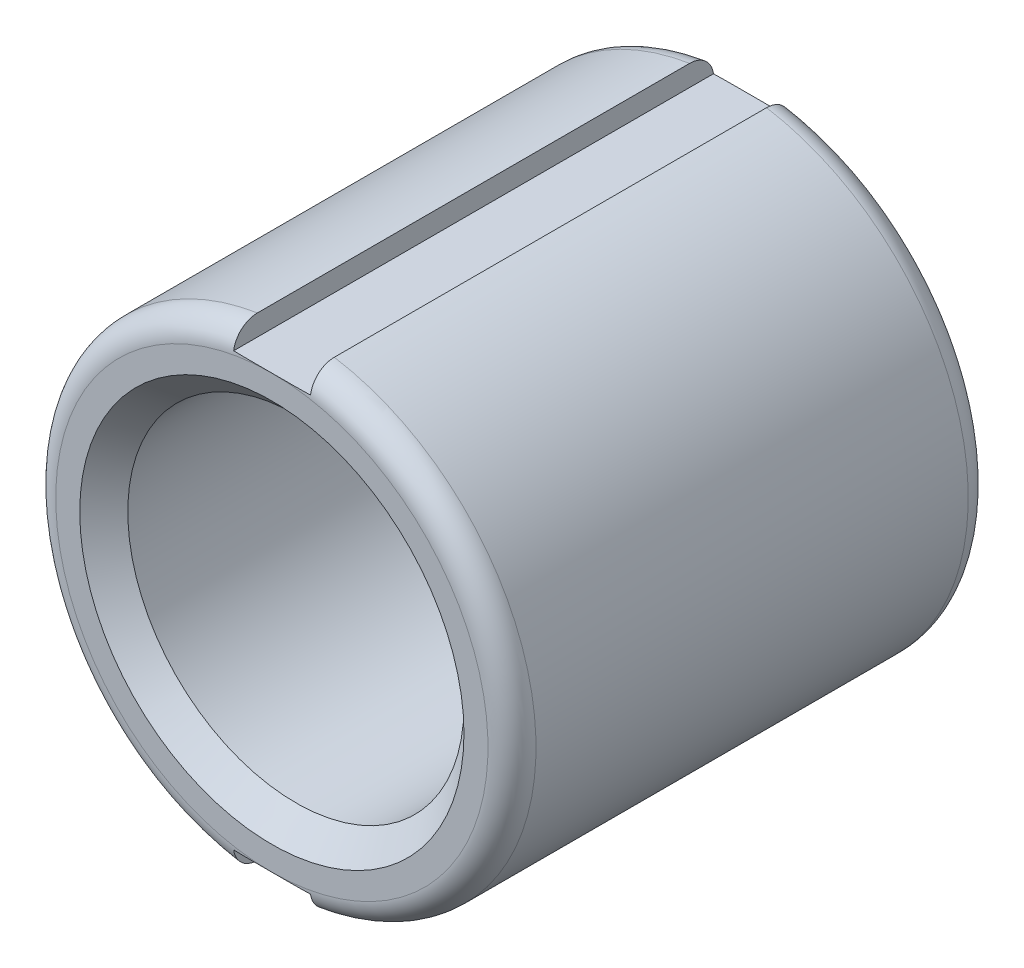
SolidWorks part; units mm, degrees
ref_plane "Front" through (0, 0, 0) normal (0, 0, 1) x (1, 0, 0)
ref_plane "Top" through (0, 0, 0) normal (0, 1, 0) x (1, 0, 0)
ref_plane "Right" through (0, 0, 0) normal (1, 0, 0) x (0, 0, -1)
sketch "Sketch1" plane through (0, 0, 0) normal (0, 1, 0) x (1, 0, 0)
  line L0 (5, 0) -> (0, 0)
  line L1 (0, 0) -> (0, -10)
  line L2 (0, -10) -> (5, -10)
  line L3 (5, -10) -> (5, 0)
  line L4 (0, 0) -> (0, -10) construction
  dimension "D1" = 5
  dimension "D2" = 10
revolve "Revolve1" add sketch "Sketch1" angle 360 about L4
sketch "Sketch2" plane through (0, 0, 0) normal (0, 0, -1) x (-1, 0, 0)
  line L0 (-0.8, 4.9356) -> (-0.8, 4.5)
  line L1 (-0.8, 4.5) -> (0.8, 4.5)
  line L2 (0.8, 4.5) -> (0.8, 4.9356)
  arc A0 (0.8, 4.9356) -> (-0.8, 4.9356) centre (0, 0) ccw
  circle A1 centre (0, 0) radius 5 construction
  dimension "D1" = 5
  dimension "D2" = 0.8
  dimension "D3" = 0.8
  dimension "D4" = 4.5
  dimension "D5" = 4.9356
extrude "Cut-Extrude1" cut sketch "Sketch2" against normal through all
sketch "Sketch3" plane through (0, 0, 0) normal (0, 0, -1) x (-1, 0, 0)
  line L0 (0.8, -4.9356) -> (0.8, -4.5)
  line L1 (0.8, -4.5) -> (-0.8, -4.5)
  line L2 (-0.8, -4.5) -> (-0.8, -4.9356)
  line L3 (0.8, 4.5) -> (0.8, 4.9356) construction
  line L4 (-0.8, 4.5) -> (0.8, 4.5) construction
  arc A0 (-0.8, -4.9356) -> (0.8, -4.9356) centre (0, 0) ccw
  dimension "D1" = 5
  dimension "D2" = 0.8
  dimension "D3" = 1.6
  dimension "D4" = 4.5
  dimension "D5" = 9
extrude "Cut-Extrude2" cut sketch "Sketch3" against normal through all
hole_wizard "1/4 Clearance Hole1" positions "Sketch5" profile "Sketch4" hole size "1/4" standard "ANSI Inch"
sketch "Sketch5" plane through (0, 0, 10) normal (0, 0, 1) x (1, 0, 0)
  point P0 (0, 0)
sketch "Sketch4" plane through (0, 0, 10) normal (1, 0, 0) x (0, -1, 0)
  line L0 (0, 0) -> (0, 10)
  line L1 (0, 10) -> (3.5, 10)
  line L2 (3.5, 10) -> (3.5, 0)
  line L5 (3.5, 0) -> (0, 0)
  line L11 (0, -6.35) -> (0, 107.95) construction
  dimension "Thru Hole Dia." = 7
  dimension "Thru Hole Depth" = 10
chamfer "Chamfer1" distance 0.5 angle 45 2 edges at (3.5, 0, 0) (3.5, 0, 10)
fillet "Fillet1" radius 0.5 4 edges at (-5, 0, 0) (-5, 0, 10) (5, 0, 0) (5, 0, 10)
